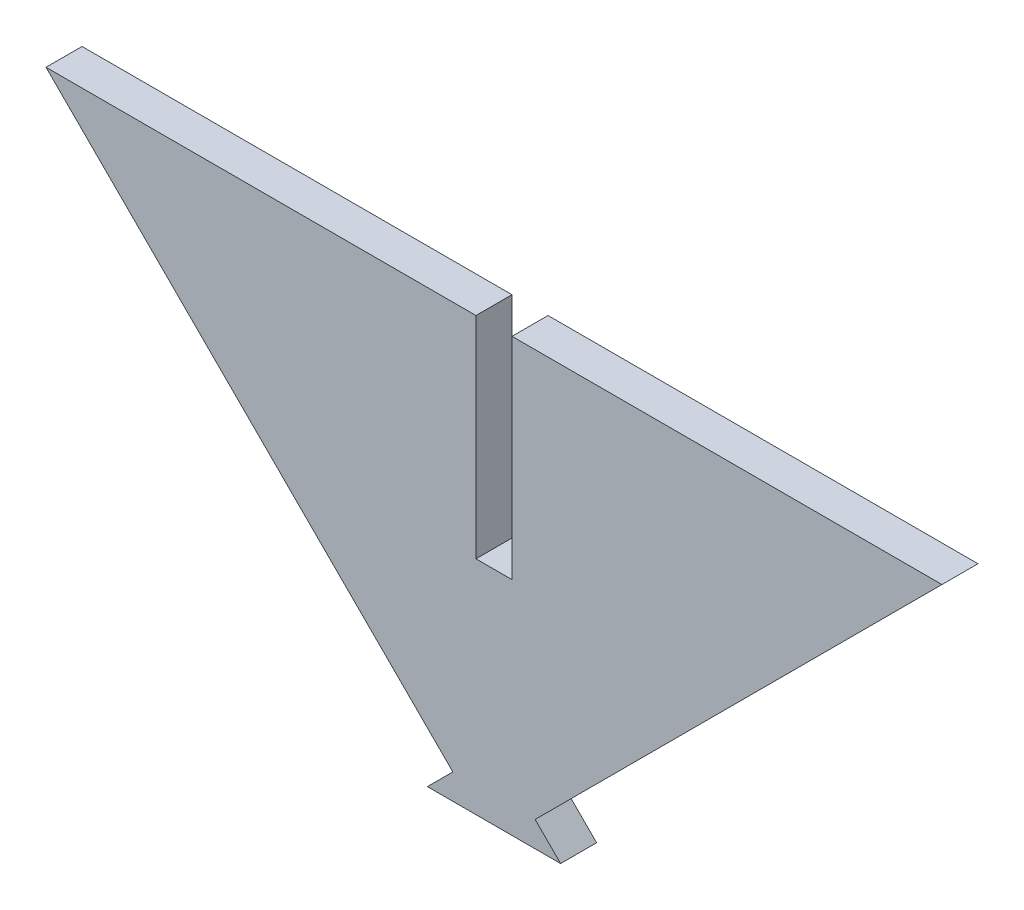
SolidWorks part; units mm, degrees
ref_plane "Front Plane" through (0, 0, 0) normal (0, 0, 1) x (1, 0, 0)
ref_plane "Top Plane" through (0, 0, 0) normal (0, 1, 0) x (1, 0, 0)
ref_plane "Right Plane" through (0, 0, 0) normal (1, 0, 0) x (0, 0, -1)
sketch "Sketch1" plane through (0, 0, 0) normal (0, 0, 1) x (1, 0, 0)
  line L0 (-498.0077, 515.9682) -> (-14.5051, 32.4656) construction
  line L1 (-6.35, 785.3759) -> (-6.35, 101.6) construction
  line L2 (6.35, 785.3759) -> (6.35, 101.6) construction
  line L3 (498.0077, 515.9682) -> (14.5051, 32.4656) construction
  line L4 (-157.9249, 175.8854) -> (-14.5051, 32.4656)
  line L5 (-6.35, 175.8854) -> (-6.35, 101.6)
  line L6 (6.35, 175.8854) -> (6.35, 101.6)
  line L7 (157.9249, 175.8854) -> (14.5051, 32.4656)
  line L8 (23.4854, 23.4854) -> (14.5051, 32.4656) construction
  line L9 (-14.5051, 32.4656) -> (-23.4854, 23.4854) construction
  line L10 (23.4854, 23.4854) -> (14.5051, 32.4656)
  line L11 (-14.5051, 32.4656) -> (-23.4854, 23.4854)
  line L12 (23.4854, 23.4854) -> (-23.4854, 23.4854)
  line L13 (157.9249, 175.8854) -> (6.35, 175.8854)
  line L14 (6.35, 101.6) -> (-6.35, 101.6) construction
  line L15 (6.35, 101.6) -> (-6.35, 101.6)
  line L16 (-6.35, 175.8854) -> (-157.9249, 175.8854)
  dimension "D1" = 152.4
extrude "Extrude1" add sketch "Sketch1" against normal blind 12.7
